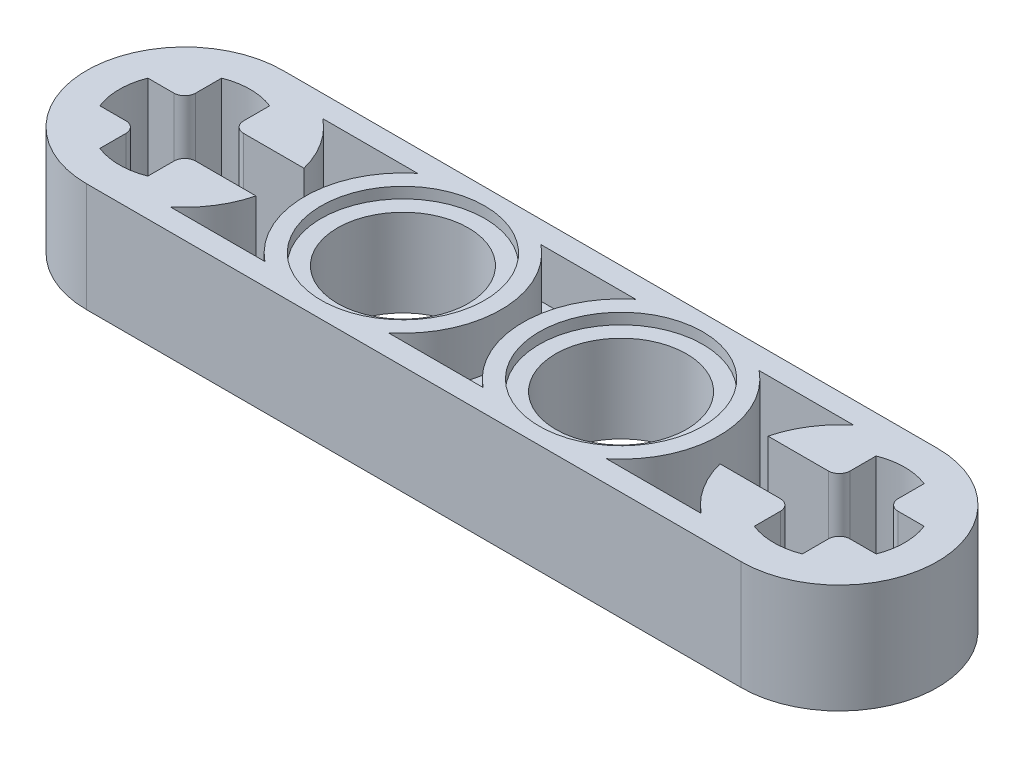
SolidWorks part; units mm, degrees
ref_plane "Front Plane" through (0, 0, 0) normal (0, 0, 1) x (1, 0, 0)
ref_plane "Top Plane" through (0, 0, 0) normal (0, 1, 0) x (1, 0, 0)
ref_plane "Right Plane" through (0, 0, 0) normal (1, 0, 0) x (0, 0, -1)
sketch "Sketch1" plane through (0, 0, 0) normal (0, 1, 0) x (1, 0, 0)
  line L0 (-12, 3.6) -> (12, 3.6)
  line L1 (12, -3.6) -> (-12, -3.6)
  line L2 (-14.2328, 0.88) -> (-13.28, 0.88)
  line L3 (-14.2328, -0.88) -> (-13.28, -0.88)
  line L4 (-11.12, 2.2328) -> (-11.12, 1.28)
  line L5 (-12.88, -2.2328) -> (-12.88, -1.28)
  line L6 (11.12, 2.2328) -> (11.12, 1.28)
  line L7 (12.88, -2.2328) -> (12.88, -1.28)
  line L8 (14.2328, 0.88) -> (13.28, 0.88)
  line L9 (-10.72, 0.88) -> (-9.7672, 0.88)
  line L10 (9.7672, -0.88) -> (10.72, -0.88)
  line L11 (-12.88, 1.28) -> (-12.88, 2.2328)
  line L12 (-10.72, -0.88) -> (-9.7672, -0.88)
  line L13 (-11.12, -1.28) -> (-11.12, -2.2328)
  line L14 (10.72, 0.88) -> (9.7672, 0.88)
  line L15 (13.28, -0.88) -> (14.2328, -0.88)
  line L16 (11.12, -1.28) -> (11.12, -2.2328)
  line L17 (12.88, 1.28) -> (12.88, 2.2328)
  line L18 (-9.7373, 2.8) -> (-6.2627, 2.8)
  line L19 (-9.7373, -2.8) -> (-6.2627, -2.8)
  line L22 (6.2627, 2.8) -> (9.7373, 2.8)
  line L23 (6.2627, -2.8) -> (9.7373, -2.8)
  line L24 (-9.7672, 0.88) -> (-8.5092, 0.88)
  line L25 (-9.7672, -0.88) -> (-8.5092, -0.88)
  line L26 (9.7672, 0.88) -> (8.5092, 0.88)
  line L27 (9.7672, -0.88) -> (8.5092, -0.88)
  circle A0 centre (-4, 0) radius 2.4
  circle A1 centre (4, 0) radius 2.4
  arc A3 (-12.88, -2.2328) -> (-11.12, -2.2328) centre (-12, 0) ccw
  arc A7 (-11.12, 2.2328) -> (-12.88, 2.2328) centre (-12, 0) ccw
  arc A8 (-14.2328, 0.88) -> (-14.2328, -0.88) centre (-12, 0) ccw
  arc A9 (11.12, -2.2328) -> (12.88, -2.2328) centre (12, 0) ccw
  arc A10 (14.2328, -0.88) -> (14.2328, 0.88) centre (12, 0) ccw
  arc A11 (12.88, 2.2328) -> (11.12, 2.2328) centre (12, 0) ccw
  arc A12 (13.28, 0.88) -> (12.88, 1.28) centre (13.28, 1.28) cw
  arc A13 (13.28, -0.88) -> (12.88, -1.28) centre (13.28, -1.28) ccw
  arc A14 (10.72, -0.88) -> (11.12, -1.28) centre (10.72, -1.28) cw
  arc A15 (10.72, 0.88) -> (11.12, 1.28) centre (10.72, 1.28) ccw
  arc A16 (-10.72, 0.88) -> (-11.12, 1.28) centre (-10.72, 1.28) cw
  arc A17 (-10.72, -0.88) -> (-11.12, -1.28) centre (-10.72, -1.28) ccw
  arc A18 (-12.88, -1.28) -> (-13.28, -0.88) centre (-13.28, -1.28) ccw
  arc A19 (-13.28, 0.88) -> (-12.88, 1.28) centre (-13.28, 1.28) ccw
  arc A22 (-12, 3.6) -> (-12, -3.6) centre (-12, 0) ccw
  arc A23 (9.7373, 2.8) -> (8.5092, 0.88) centre (12, 0) ccw
  arc A24 (-9.7373, -2.8) -> (-8.5092, -0.88) centre (-12, 0) ccw
  arc A25 (-6.2627, 2.8) -> (-6.2627, -2.8) centre (-4, 0) ccw
  arc A26 (6.2627, -2.8) -> (6.2627, 2.8) centre (4, 0) ccw
  arc A27 (12, -3.6) -> (12, 3.6) centre (12, 0) ccw
  arc A28 (8.5092, -0.88) -> (9.7373, -2.8) centre (12, 0) ccw
  arc A29 (-8.5092, 0.88) -> (-9.7373, 2.8) centre (-12, 0) ccw
  point P39 (12.88, 0.88)
  point P44 (11.12, -0.88)
  point P51 (-11.12, -0.88)
  point P56 (-12.88, 0.88)
  dimension "D1" = 4
  dimension "D2" = 4.8
  dimension "D3" = 4
  dimension "D4" = 8
  dimension "D15" = 0.4
  dimension "D6" = 3.6
  dimension "D7" = 3.6
  dimension "D8" = 0.88
  dimension "D9" = 1.76
  dimension "D10" = 0.88
  dimension "D11" = 1.76
  dimension "D12" = 1.76
  dimension "D13" = 0.88
  dimension "D14" = 1.76
  dimension "D16" = 0.8
  dimension "D17" = 0.8
extrude "Boss-Extrude1" add sketch "Sketch1" along normal blind 4
sketch "Sketch2" plane through (0, 4, 0) normal (0, 1, 0) x (1, 0, 0)
  line L0 (-1.7373, 2.8) -> (1.7373, 2.8)
  line L1 (-1.7373, -2.8) -> (1.7373, -2.8)
  line L2 (12, 3.6) -> (-12, 3.6) construction
  line L3 (-12, -3.6) -> (12, -3.6) construction
  arc A0 (-1.7373, -2.8) -> (-1.7373, 2.8) centre (-4, 0) ccw
  arc A1 (1.7373, 2.8) -> (1.7373, -2.8) centre (4, 0) ccw
  dimension "D1" = 0.8
  dimension "D2" = 0.8
extrude "Cut-Extrude1" cut sketch "Sketch2" against normal blind 1.8
ref_plane "Plane1" through (0, 2, 0) normal (0, -1, 0) x (-1, 0, 0)
mirror "Mirror1" about plane through (0, 2, 0) normal (0, -1, 0) of "Cut-Extrude1"
sketch "Sketch3" plane through (0, 0, 0) normal (0, -1, 0) x (1, 0, 0)
  circle A0 centre (-4, 0) radius 3
  circle A1 centre (4, 0) radius 3
extrude "Cut-Extrude2" cut sketch "Sketch3" against normal blind 0.4
mirror "Mirror2" about plane through (0, 2, 0) normal (0, -1, 0) of "Cut-Extrude2"
